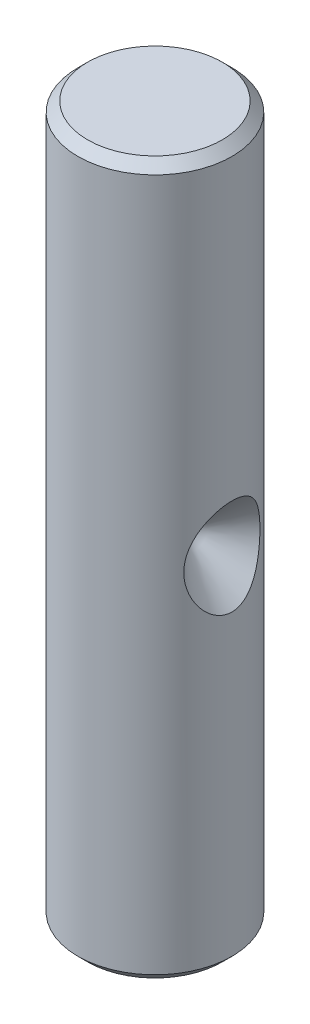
SolidWorks part; units mm, degrees
ref_plane "Plan de face" through (0, 0, 0) normal (0, 0, 1) x (1, 0, 0)
ref_plane "Plan de dessus" through (0, 0, 0) normal (0, 1, 0) x (1, 0, 0)
ref_plane "Plan de droite" through (0, 0, 0) normal (1, 0, 0) x (0, 0, -1)
sketch "Esquisse1" plane through (0, 0, 0) normal (0, 1, 0) x (1, 0, 0)
  circle A0 centre (0, 0) radius 4
  dimension "D1" = 8
extrude "Extrusion1" add sketch "Esquisse1" along normal blind 37
chamfer "Chanfrein1" distance 0.5 angle 45 2 edges at (0, 0, 4) (0, 37, 4)
sketch "Esquisse3" plane through (0, 0, 0) normal (0, 0, 1) x (1, 0, 0)
  line L0 (6.7518, 18.5) -> (0.2196, 18.5) construction
  line L1 (3.5, 37) -> (-3.5, 37) construction
  line L2 (1.5, 18.5) -> (5.3022, 22.3022)
  line L3 (5.3022, 22.3022) -> (5.3022, 18.5)
  line L4 (4, 0.5) -> (4, 36.5) construction
  line L5 (1.5, 18.5) -> (5.3022, 18.5)
  dimension "D1" = 18.5
  dimension "D2" = 2.5
  dimension "D3" = 45
revolve "Enlèvement de matière-Révolution7" cut sketch "Esquisse3" angle 360 about L0
